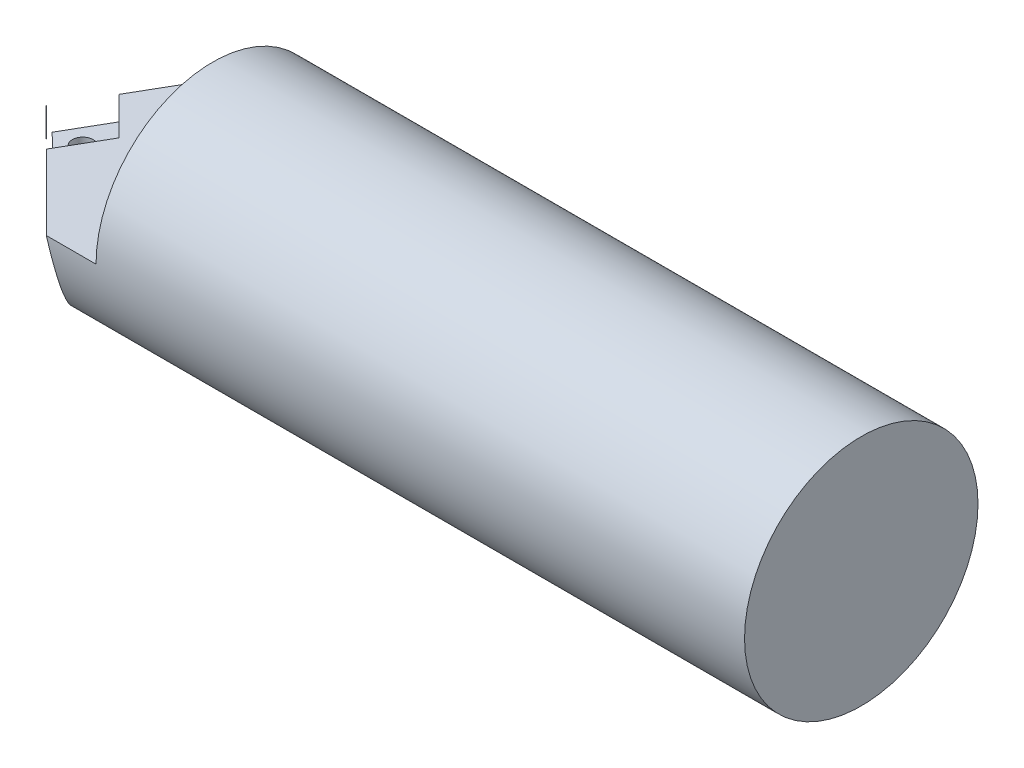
SolidWorks part; units mm, degrees
ref_plane "Front Plane" through (0, 0, 0) normal (0, 0, 1) x (1, 0, 0)
ref_plane "Top Plane" through (0, 0, 0) normal (0, 1, 0) x (1, 0, 0)
ref_plane "Right Plane" through (0, 0, 0) normal (1, 0, 0) x (0, 0, -1)
sketch "Sketch1" plane through (0, 0, 0) normal (1, 0, 0) x (0, 0, -1)
  circle A0 centre (0, 0) radius 18
extrude "Boss-Extrude1" add sketch "Sketch1" along normal mid plane 125
sketch "Sketch2" plane through (0, 0, 0) normal (0, 1, 0) x (1, 0, 0)
  line L0 (0, 0) -> (-81.4835, 0) construction
  line L1 (-62.5, -18) -> (62.5, -18) construction
  line L2 (-62.5, 18) -> (-37.5, 18)
  line L3 (-62.5, 18) -> (-62.5, -18)
  line L4 (-62.5, -18) -> (-37.5, -18)
  line L5 (-37.5, 18) -> (-37.5, -18)
  line L6 (-62.5, 18) -> (-37.5, -18) construction
  line L7 (-62.5, -18) -> (-37.5, 18) construction
  line L8 (-62.5, 18) -> (-62.5, -18) construction
  point P3 (-50, 0)
  dimension "D1" = 25
extrude "Cut-Extrude1" cut sketch "Sketch2" along normal through all
sketch "Sketch3" plane through (0, 0, 0) normal (0, 1, 0) x (1, 0, 0)
  line L0 (-62.5, 0) -> (-57.55, 0) construction
  line L1 (-62.5, 18) -> (-62.5, -18) construction
  line L2 (-62.5113, -0.6532) -> (-56.6988, -6.4656)
  line L3 (-56.6988, -6.4656) -> (-52.5887, 0.6532)
  line L4 (-52.5887, 0.6532) -> (-58.4012, 6.4656)
  line L5 (-58.4012, 6.4656) -> (-62.5113, -0.6532)
  circle A0 centre (-57.55, 0) radius 3.97 construction
  point P8 (0, 0)
  point P11 (-57.5, 0)
  point P12 (-58.5502, 6.4363)
  point P13 (-54.6182, 5.8501)
  point P14 (-63.5607, -2.4078)
  point P15 (-63.7338, 1.9154)
  point P16 (-63.716, -1.9724)
  point P17 (-54.7829, -5.9284)
  point P18 (-52.518, 0)
  point P19 (0, 0)
  point P20 (-58.39, 6.4656)
  point P21 (-62.5, -0.6532)
  point P22 (-60.9812, -0.6532)
  point P23 (-62.2808, -0.6532)
  point P24 (-62.9129, -0.6532)
  point P25 (0, 0)
  point P26 (0, 0)
  point P27 (0, 0)
  point P28 (0, 0)
  point P29 (0, 0)
  point P30 (-62.5855, -0.6532)
  dimension "D2" = 7.94
  dimension "D1" = 4.95
  dimension "D3" = 75
  dimension "D4" = 75
  dimension "D5" = 45
extrude "Cut-Extrude13" cut sketch "Sketch3" against normal blind 3.18
sketch "Sketch4" plane through (0, 0, 0) normal (0, 1, 0) x (1, 0, 0)
  line L0 (-56.6988, -6.4656) -> (-38.9156, -24.2488)
  line L1 (-62.5, -0.6644) -> (-56.6988, -6.4656) construction
  line L2 (-58.4012, 6.4656) -> (-47.8155, 24.8007)
  line L3 (-58.4012, 6.4656) -> (-62.5, -0.6337) construction
  line L4 (-47.8155, 24.8007) -> (-77.6143, 24.8007)
  line L5 (-77.6143, 24.8007) -> (-77.6143, -24.2488)
  line L6 (-77.6143, -24.2488) -> (-38.9156, -24.2488)
  line L7 (-58.4012, 6.4656) -> (-62.5298, -0.6853)
  line L8 (-56.6988, -6.4656) -> (-62.5298, -0.6853)
  line L9 (-62.5, -0.6644) -> (-62.5, -18) construction
  point P10 (0, 0)
  point P13 (-77.5452, -21.9746)
  point P15 (-62.5855, -0.7739)
  point P16 (0, 0)
  dimension "D1" = 180
  dimension "D2" = 180
extrude "Cut-Extrude14" cut sketch "Sketch4" against normal through all draft 12
sketch "Sketch5" plane through (0, -3.18, 0) normal (0, 1, 0) x (1, 0, 0)
  circle A0 centre (-57.55, 0) radius 3.97 construction
  circle A1 centre (-57.55, 0) radius 3.97 construction
  circle A2 centre (-57.55, 0) radius 1.6
  dimension "D1" = 3.2
extrude "Cut-Extrude15" cut sketch "Sketch5" against normal through all contours A2
